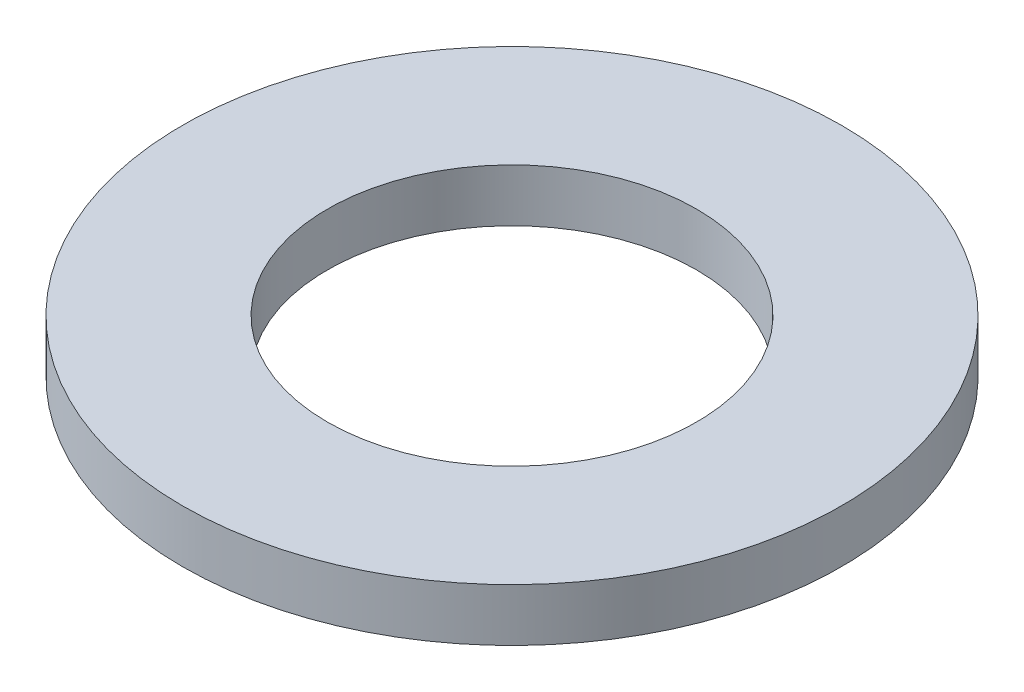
SolidWorks part; units mm, degrees
ref_plane "Front" through (0, 0, 0) normal (0, 0, 1) x (1, 0, 0)
ref_plane "Top" through (0, 0, 0) normal (0, 1, 0) x (1, 0, 0)
ref_plane "Right" through (0, 0, 0) normal (1, 0, 0) x (0, 0, -1)
sketch "Sketch1" plane through (0, 0, 0) normal (0, 1, 0) x (1, 0, 0)
  circle A0 centre (0, 0) radius 14
  circle A1 centre (0, 0) radius 25
extrude "Extrude1" add sketch "Sketch1" along normal blind 4
